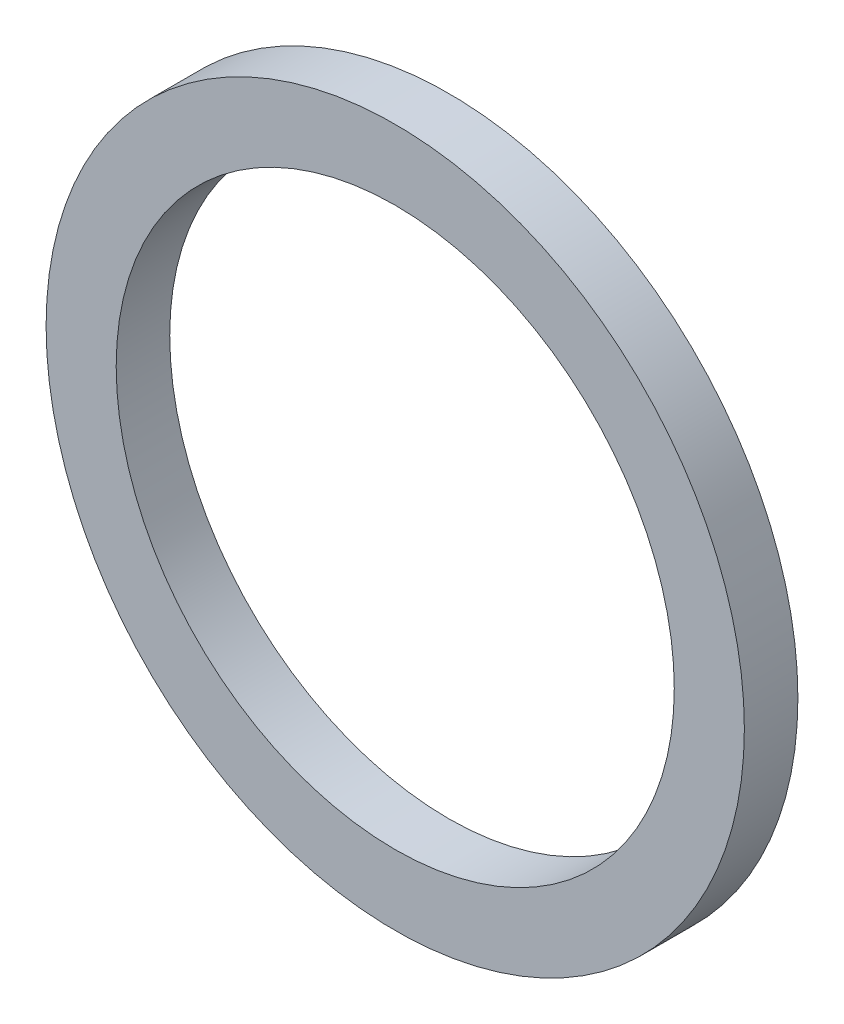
SolidWorks part; units mm, degrees
ref_plane "Front" through (0, 0, 0) normal (0, 0, 1) x (1, 0, 0)
ref_plane "Top" through (0, 0, 0) normal (0, 1, 0) x (1, 0, 0)
ref_plane "Right" through (0, 0, 0) normal (1, 0, 0) x (0, 0, -1)
sketch "Sketch1" plane through (0, 0, 0) normal (0, 0, 1) x (1, 0, 0)
  circle A0 centre (0, 0) radius 7.5
extrude "Boss-Extrude1" add sketch "Sketch1" along normal blind 1.15
sketch "Sketch2" plane through (0, 0, 1.15) normal (0, 0, 1) x (1, 0, 0)
  circle A0 centre (0, 0) radius 5.9944
extrude "Cut-Extrude1" cut sketch "Sketch2" against normal up to surface (1.15 mm away)
